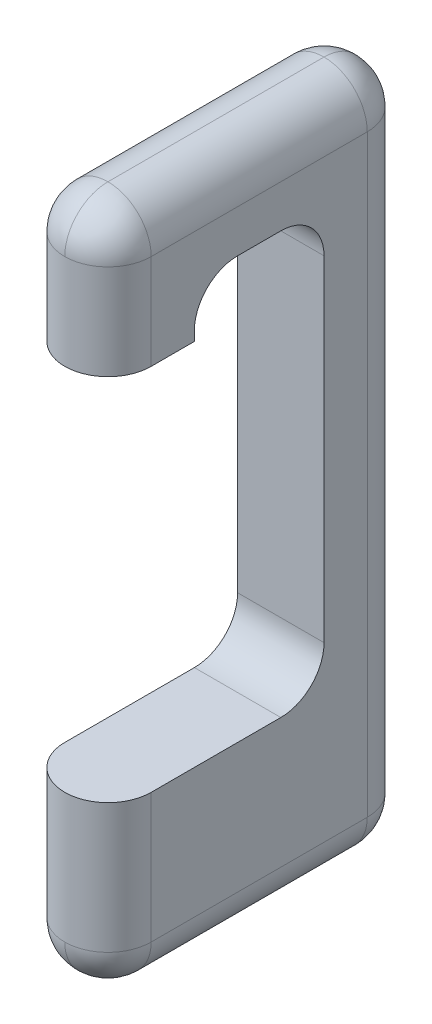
SolidWorks part; units mm, degrees
ref_plane "Front" through (0, 0, 0) normal (0, 0, 1) x (1, 0, 0)
ref_plane "Top" through (0, 0, 0) normal (0, 1, 0) x (1, 0, 0)
ref_plane "Right" through (0, 0, 0) normal (1, 0, 0) x (0, 0, -1)
sketch "Sketch1" plane through (0, 0, 0) normal (1, 0, 0) x (0, 0, -1)
  line L0 (-12.7, 8.5217) -> (-8.7313, 8.5217)
  line L1 (-9.525, 0) -> (-9.525, 6.1531)
  line L2 (-11.9063, 5.9817) -> (-13.4938, 5.9817)
  line L3 (-13.4938, 5.9817) -> (-13.4938, 7.7279)
  line L4 (-11.1125, 6.9469) -> (-10.3187, 6.9469)
  line L5 (-7.9375, 7.7279) -> (-7.9375, -3.175)
  line L6 (-8.7312, -3.9688) -> (-12.7, -3.9688)
  line L7 (-13.4938, -3.175) -> (-13.4938, -0.7938)
  line L8 (-12.7, 8.6722) -> (-12.7, -3.9688) construction
  line L9 (-11.9063, 5.9817) -> (-11.9062, -3.9688) construction
  line L10 (-11.9063, 5.9817) -> (-11.9063, 6.1531)
  line L12 (-10.3188, -0.7938) -> (-13.4938, -0.7938)
  arc A0 (-12.7, -3.9688) -> (-13.4938, -3.175) centre (-12.7, -3.175) cw
  arc A1 (-7.9375, -3.175) -> (-8.7312, -3.9688) centre (-8.7312, -3.175) cw
  arc A2 (-8.7313, 8.5217) -> (-7.9375, 7.7279) centre (-8.7313, 7.7279) cw
  arc A3 (-12.7, 8.5217) -> (-13.4938, 7.7279) centre (-12.7, 7.7279) ccw
  arc A4 (-11.9063, 6.1531) -> (-11.1125, 6.9469) centre (-11.1125, 6.1531) cw
  arc A5 (-9.525, 6.1531) -> (-10.3187, 6.9469) centre (-10.3187, 6.1531) ccw
  arc A6 (-9.525, 0) -> (-10.3188, -0.7938) centre (-10.3187, 0) cw
  dimension "D11" = 0.7937
  dimension "D1" = 12.7
  dimension "D2" = 13.4938
  dimension "D3" = 9.525
  dimension "D4" = 7.9375
  dimension "D5" = 1.5875
  dimension "D6" = 0.7937
  dimension "D7" = 0.9652
  dimension "D8" = 5.9817
  dimension "D9" = 0.7937
  dimension "D10" = 1.5748
  dimension "D12" = 3.175
  dimension "D13" = 1.5875
extrude "Boss-Extrude1" add sketch "Sketch1" along normal mid plane 1.5875
sketch "Sketch2" plane through (0, 0, 0) normal (0, 1, 0) x (1, 0, 0)
  line L0 (0.7938, -12.7) -> (-0.7937, -12.7) construction
  line L1 (0.7937, -13.4938) -> (-0.7937, -13.4938) construction
  line L2 (-0.7937, -10.3188) -> (-0.7937, -13.4938) construction
  line L3 (0.7937, -10.3188) -> (0.7937, -13.4938) construction
  line L4 (0.7937, -7.9375) -> (-0.7937, -7.9375) construction
  line L5 (0.7937, -11.1125) -> (0.7937, -10.3187) construction
  line L6 (-0.7938, -8.7313) -> (0.7937, -8.7313) construction
  line L7 (-0.7937, -11.1125) -> (-0.7937, -10.3187) construction
  line L8 (-0.7937, -12.7) -> (-0.7938, -8.7313)
  line L9 (0.7938, -12.7) -> (0.7937, -8.7313)
  arc A0 (-0.7937, -12.7) -> (0.7938, -12.7) centre (0, -12.7) ccw
  arc A1 (0.7937, -8.7313) -> (-0.7938, -8.7313) centre (0, -8.7313) ccw
  dimension "D1" = 0.7938
extrude "Cut-Extrude1" cut sketch "Sketch2" against normal through all and the other way through all flip side to cut
fillet "Fillet1" radius 0.7937 12 edges at (0.5613, -3.7363, 13.2613) (0.5613, -3.7363, 8.17) (-0.5613, -3.7363, 13.2613) (-0.5613, -3.7363, 8.17) (-0.5613, 8.2892, 8.17) (-0.5613, 8.2892, 13.2613) (0.5613, 8.2892, 8.17) (0.5613, 8.2892, 13.2613) (0.7938, -3.9688, 10.7156) (-0.7937, -3.9688, 10.7156) (-0.7937, 8.5217, 10.7156) (0.7938, 8.5217, 10.7156)
